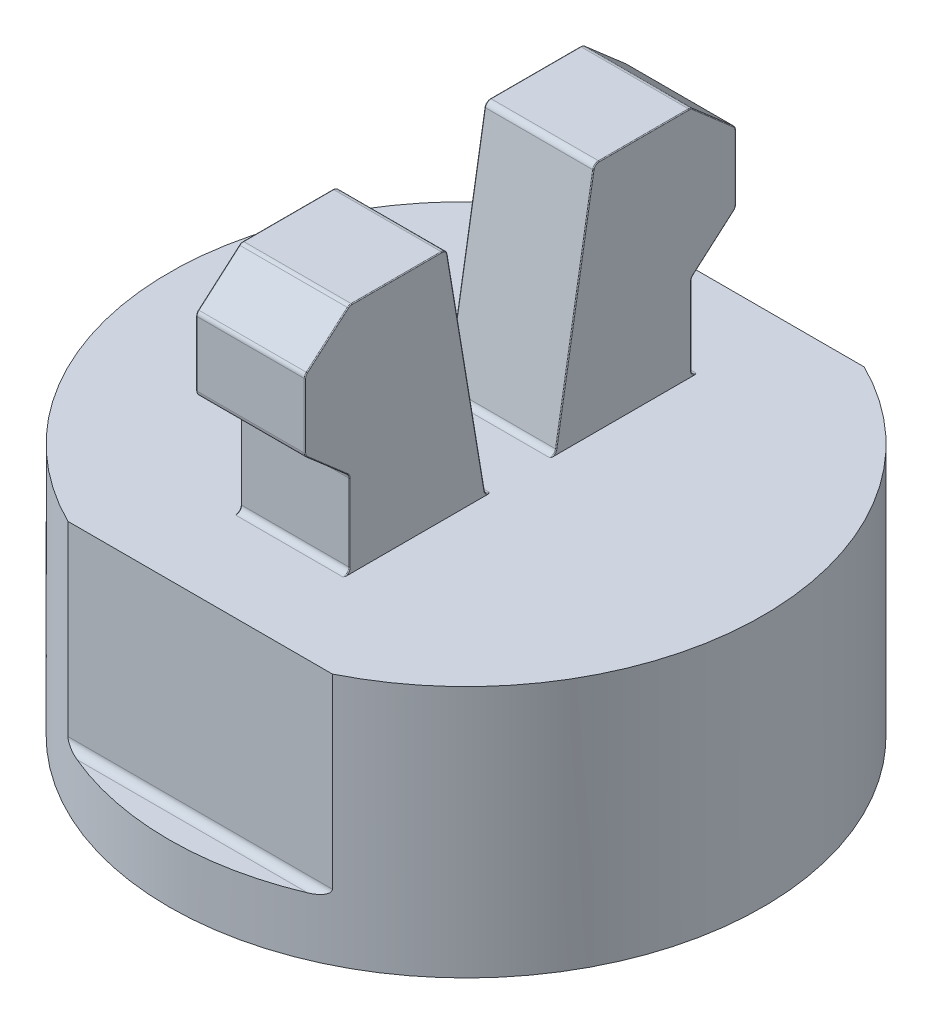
SolidWorks part; units mm, degrees
ref_plane "Front Plane" through (0, 0, 0) normal (0, 0, 1) x (1, 0, 0)
ref_plane "Top Plane" through (0, 0, 0) normal (0, 1, 0) x (1, 0, 0)
ref_plane "Right Plane" through (0, 0, 0) normal (1, 0, 0) x (0, 0, -1)
sketch "Sketch1" plane through (0, 0, 0) normal (0, 1, 0) x (1, 0, 0)
  circle A0 centre (0, 0) radius 7.65
extrude "Boss-Extrude1" add sketch "Sketch1" along normal blind 6.5
sketch "Sketch6" plane through (0, 6.5, 0) normal (0, 1, 0) x (1, 0, 0)
  line L1 (-4.4, -4.4) -> (4.4, -4.4)
  line L2 (-4.4, -4.4) -> (-4.4, 4.4)
  line L3 (-4.4, 4.4) -> (4.4, 4.4)
  line L4 (4.4, -4.4) -> (4.4, 4.4)
  line L5 (-4.4, -4.4) -> (4.4, 4.4) construction
  line L6 (-4.4, 4.4) -> (4.4, -4.4) construction
  point P0 (0, 0)
  dimension "D1" = 8.8
sketch "Sketch7" plane through (0, 6.5, 0) normal (0, 1, 0) x (1, 0, 0)
  line L0 (-4.4, 4.4) -> (4.4, 4.4) construction
  line L1 (-1.4, 4.4) -> (1.4, 4.4)
  line L2 (-1.4, 4.4) -> (-1.4, 0.9)
  line L3 (-1.4, 0.9) -> (1.4, 0.9)
  line L4 (1.4, 4.4) -> (1.4, 0.9)
  line L5 (-4.4, -4.4) -> (-4.4, 4.4) construction
  line L6 (-3.575, 0) -> (3.575, 0) construction
  line L7 (1.4, -4.4) -> (1.4, -0.9)
  line L8 (-1.4, -0.9) -> (1.4, -0.9)
  line L9 (-1.4, -4.4) -> (-1.4, -0.9)
  line L10 (-1.4, -4.4) -> (1.4, -4.4)
  dimension "D1" = 3.5
  dimension "D2" = 3
  dimension "D3" = 2.8
ref_plane "Plane2" through (0, 12.5, 0) normal (0, 1, 0) x (1, 0, 0)
sketch "Sketch8" plane through (0, 12.5, 0) normal (0, 1, 0) x (1, 0, 0)
  line L0 (1.4, 4.4) -> (1.4, 0.9) construction
  line L1 (-1.4, 4.4) -> (1.4, 4.4)
  line L2 (-1.4, 4.4) -> (-1.4, 1.9)
  line L3 (-1.4, 1.9) -> (1.4, 1.9)
  line L4 (1.4, 4.4) -> (1.4, 1.9)
  line L5 (-1.4, 0.9) -> (1.4, 0.9) construction
  line L6 (-3.575, 0) -> (3.575, 0) construction
  line L7 (1.4, -4.4) -> (1.4, -1.9)
  line L8 (-1.4, -1.9) -> (1.4, -1.9)
  line L9 (-1.4, -4.4) -> (-1.4, -1.9)
  line L10 (-1.4, -4.4) -> (1.4, -4.4)
  dimension "D1" = 1
loft "Loft1" add
sketch "Sketch10" plane through (0, 0, -4.4) normal (0, 0, -1) x (-1, 0, 0)
  line L0 (1.4, 6.5) -> (1.4, 12.5) construction
  line L1 (-1.4, 12.5) -> (1.4, 12.5)
  line L2 (-1.4, 12.5) -> (-1.4, 8.7)
  line L3 (-1.4, 8.7) -> (1.4, 8.7)
  line L4 (1.4, 12.5) -> (1.4, 8.7)
  dimension "D1" = 3.8
ref_plane "Plane3" through (0, 0, -5.55) normal (0, 0, -1) x (-1, 0, 0)
sketch "Sketch11" plane through (0, 0, -5.55) normal (0, 0, -1) x (-1, 0, 0)
  line L0 (-1.4, 12.5) -> (-1.4, 8.7) construction
  line L1 (-1.4, 11.5) -> (1.4, 11.5)
  line L2 (-1.4, 11.5) -> (-1.4, 9.7)
  line L3 (-1.4, 9.7) -> (1.4, 9.7)
  line L4 (1.4, 11.5) -> (1.4, 9.7)
  line L5 (1.4, 12.5) -> (1.4, 8.7) construction
  line L6 (-1.4, 12.5) -> (1.4, 12.5) construction
  dimension "D1" = 1
  dimension "D2" = 1.8
loft "Loft3" add profiles "Sketch10", "Sketch11"
fillet "Fillet1" radius 0.15 7 edges
mirror "Mirror1" about plane through (0, 0, 0) normal (0, 0, 1) of "Loft1", "Loft3", "Fillet1"
sketch "Sketch12" plane through (0, 6.5, 0) normal (0, 1, 0) x (1, 0, 0)
  line L0 (-3.4059, -6.85) -> (3.4059, -6.85)
  line L1 (-7.65, -6.85) -> (7.65, -6.85) construction
  line L2 (-7.65, -6.85) -> (-7.65, 6.85) construction
  line L3 (-7.65, 6.85) -> (7.65, 6.85) construction
  line L4 (7.65, -6.85) -> (7.65, 6.85) construction
  line L5 (-7.65, -6.85) -> (7.65, 6.85) construction
  line L6 (-7.65, 6.85) -> (7.65, -6.85) construction
  line L7 (-3.4059, 6.85) -> (3.4059, 6.85)
  circle A0 centre (0, 0) radius 7.65
  dimension "D1" = 15.3
  dimension "D2" = 13.7
  dimension "D3" = 15.3
extrude "Cut-Extrude1" cut sketch "Sketch12" against normal blind 5 contours L7 M5 | L0 M5
fillet "Fillet2" radius 0.02 52 edges at (-1.4, 6.5439, -4.4439) (-1.4, 8.6938, -4.4135) (-1.4, 6.5355, -0.8699) (1.4, 6.5355, -0.8699) (1.4, 6.5439, -4.4439) (1.4, 8.6938, -4.4135) (-1.4, 6.5439, 4.4439) (-1.4, 8.6938, 4.4135) (-1.4, 6.5355, 0.8699) (1.4, 6.5355, 0.8699) (1.4, 6.5439, 4.4439) (1.4, 8.6938, 4.4135)
fillet "Fillet3" radius 0.2 2 edges at (0, 1.5, -6.85) (0, 1.5, 6.85)
